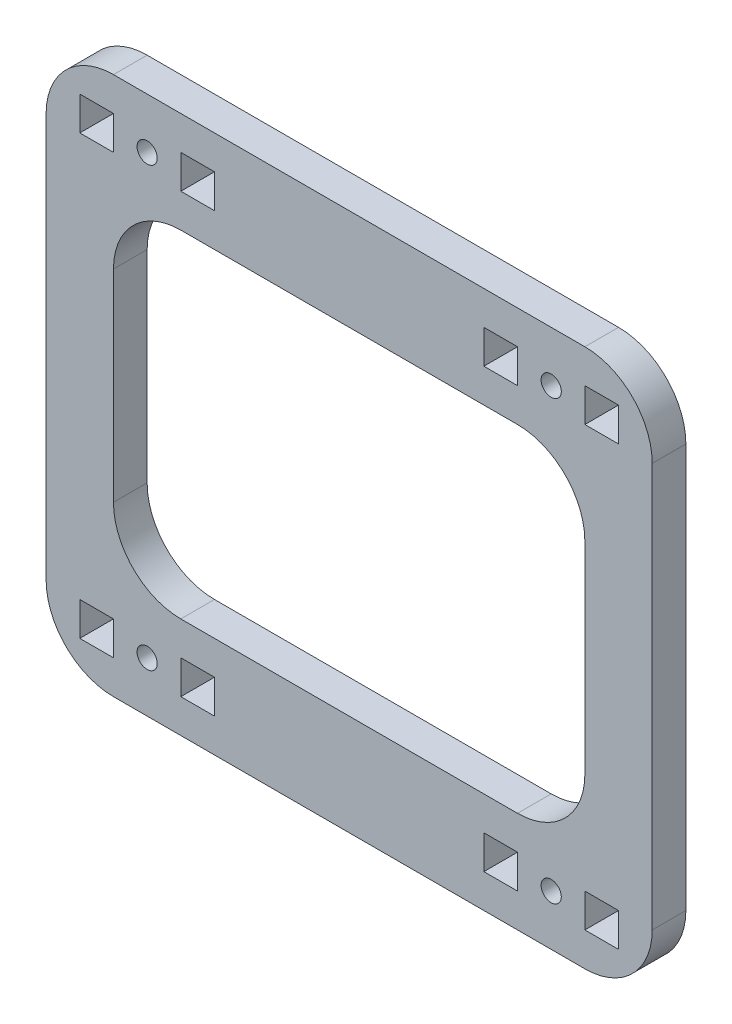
SolidWorks part; units mm, degrees
ref_plane "Plan de face" through (0, 0, 0) normal (0, 0, 1) x (1, 0, 0)
ref_plane "Plan de dessus" through (0, 0, 0) normal (0, 1, 0) x (1, 0, 0)
ref_plane "Plan de droite" through (0, 0, 0) normal (1, 0, 0) x (0, 0, -1)
sketch "Esquisse1" plane through (0, 0, 0) normal (0, 0, 1) x (1, 0, 0)
  line L0 (0, 0) -> (0, 80)
  line L1 (0, 80) -> (90, 80) construction
  line L2 (90, 80) -> (90, 0)
  line L3 (90, 0) -> (0, 0) construction
  line L4 (45, 80) -> (45, 0) construction
  line L5 (10, 65) -> (80, 65)
  line L6 (10, 65) -> (10, 15)
  line L7 (10, 15) -> (80, 15)
  line L8 (80, 65) -> (80, 15)
  line L9 (90, 40) -> (0, 40) construction
  line L10 (0, 80) -> (90, 80)
  line L11 (90, 0) -> (0, 0)
  line B0 (10, 75) -> (5, 75)
  line B1 (10, 75) -> (10, 70)
  line B2 (10, 70) -> (5, 70)
  line B3 (5, 75) -> (5, 70)
  line B4 (20, 75) -> (25, 75)
  line B5 (20, 75) -> (20, 70)
  line B6 (20, 70) -> (25, 70)
  line B7 (25, 75) -> (25, 70)
  circle B8 centre (15, 72.5) radius 1.5
  line B9 (10, 5) -> (5, 5)
  line B10 (10, 5) -> (10, 10)
  line B11 (10, 10) -> (5, 10)
  line B12 (5, 5) -> (5, 10)
  line B13 (20, 5) -> (25, 5)
  line B14 (20, 5) -> (20, 10)
  line B15 (20, 10) -> (25, 10)
  line B16 (25, 5) -> (25, 10)
  circle B17 centre (15, 7.5) radius 1.5
  line B18 (80, 75) -> (85, 75)
  line B19 (80, 75) -> (80, 70)
  line B20 (80, 70) -> (85, 70)
  line B21 (85, 75) -> (85, 70)
  line B22 (70, 75) -> (65, 75)
  line B23 (70, 75) -> (70, 70)
  line B24 (70, 70) -> (65, 70)
  line B25 (65, 75) -> (65, 70)
  circle B26 centre (75, 72.5) radius 1.5
  line B27 (80, 5) -> (85, 5)
  line B28 (80, 5) -> (80, 10)
  line B29 (80, 10) -> (85, 10)
  line B30 (85, 5) -> (85, 10)
  line B31 (70, 5) -> (65, 5)
  line B32 (70, 5) -> (70, 10)
  line B33 (70, 10) -> (65, 10)
  line B34 (65, 5) -> (65, 10)
  circle B35 centre (75, 7.5) radius 1.5
  dimension "D1" = 40
  dimension "D2" = 5
  dimension "D3" = 5
  dimension "D4" = 10
  dimension "D5" = 5
  dimension "D6" = 80
sketch_block_instance "Trou M3 plots 5mm-1"
sketch_block "Trou M3 plots 5mm" parameters "D2"=3, "D1"=5, "D3"=5, "D4"=10
sketch_block_instance "Trou M3 plots 5mm-6"
sketch_block_instance "Trou M3 plots 5mm-7"
sketch_block_instance "Trou M3 plots 5mm-8"
extrude "Boss.-Extru.1" add sketch "Esquisse1" along normal blind 5
fillet "Congé1" radius 10 8 edges at (0, 0, 2.5) (10, 15, 2.5) (90, 0, 2.5) (80, 15, 2.5) (80, 65, 2.5) (90, 80, 2.5) (10, 65, 2.5) (0, 80, 2.5)
